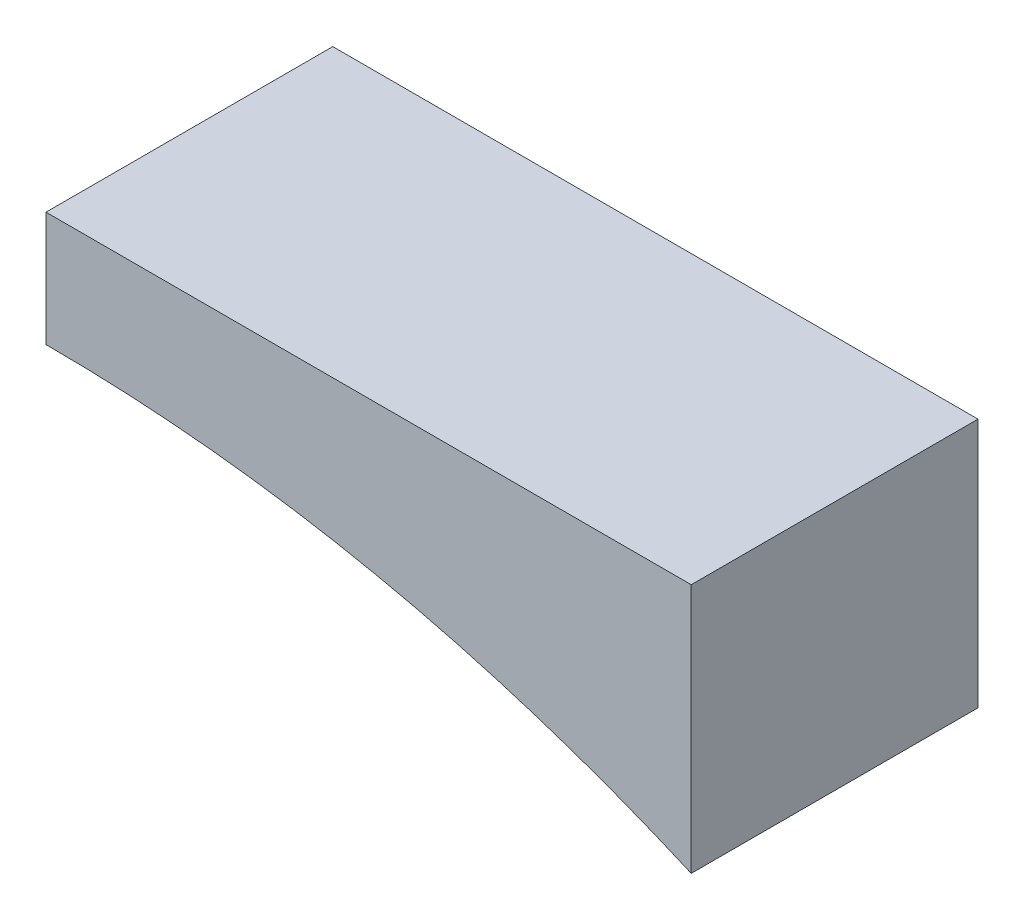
SolidWorks part; units mm, degrees
ref_plane "Plan de face" through (0, 0, 0) normal (0, 0, 1) x (1, 0, 0)
ref_plane "Plan de dessus" through (0, 0, 0) normal (0, 1, 0) x (1, 0, 0)
ref_plane "Plan de droite" through (0, 0, 0) normal (1, 0, 0) x (0, 0, -1)
sketch "Esquisse1" plane through (0, 0, 0) normal (0, 0, 1) x (1, 0, 0)
  line L0 (0, 0) -> (470.6608, 0) construction
  line L1 (0, -55.3377) -> (0, 353.7921) construction
  line L2 (0, 0) -> (442.2765, 160.9755) construction
  line L3 (0, 0) -> (360.5471, 302.5349) construction
  line L4 (0, 0) -> (235.3304, 407.6042) construction
  line L5 (0, 0) -> (81.7294, 463.5104) construction
  line L6 (0, 0) -> (-81.7294, 463.5104) construction
  line L7 (0, 0) -> (-235.3304, 407.6042) construction
  line L8 (0, 0) -> (-360.5471, 302.5349) construction
  line L9 (0, 0) -> (-442.2765, 160.9755) construction
  line L10 (0, 0) -> (-470.6608, 0) construction
  line L11 (-390.3547, -30) -> (366.2536, -30) construction
  line L12 (-390.3547, 30) -> (366.2536, 30) construction
  line L13 (-390.3547, 60) -> (366.2536, 60) construction
  line L14 (22.5, -55.3377) -> (22.5, 160.9755) construction
  line L15 (366.2536, 90) -> (-390.3547, 90) construction
  line L16 (45, -55.3377) -> (45, 160.9755) construction
  line L17 (-390.3547, 120) -> (366.2536, 120) construction
  line L18 (-90, -59.8279) -> (-90, 0) construction
  line L19 (366.2536, 150) -> (-390.3547, 150) construction
  line L20 (67.5, -55.3377) -> (67.5, 160.9755) construction
  line L21 (90, -55.3377) -> (90, 160.9755) construction
  line L22 (112.5, -55.3377) -> (112.5, 160.9755) construction
  line L23 (135, -55.3377) -> (135, 160.9755) construction
  line L24 (157.5, -55.3377) -> (157.5, 160.9755) construction
  line L25 (180, -55.3377) -> (180, 160.9755) construction
  line L26 (202.5, -55.3377) -> (202.5, 160.9755) construction
  line L27 (225, -55.3377) -> (225, 160.9755) construction
  line L28 (0, 112) -> (0, 120)
  line L29 (0, 120) -> (45, 120)
  line L30 (45, 120) -> (45, 102.5622)
  arc A0 (90, 0) -> (-90, 0) centre (0, 0) ccw construction
  arc A1 (112, 0) -> (-112, 0) centre (0, 0) ccw construction
  arc A2 (45, 102.5622) -> (0, 112) centre (0, 0) ccw
extrude "Extrusion1" add sketch "Esquisse1" along normal blind 20
